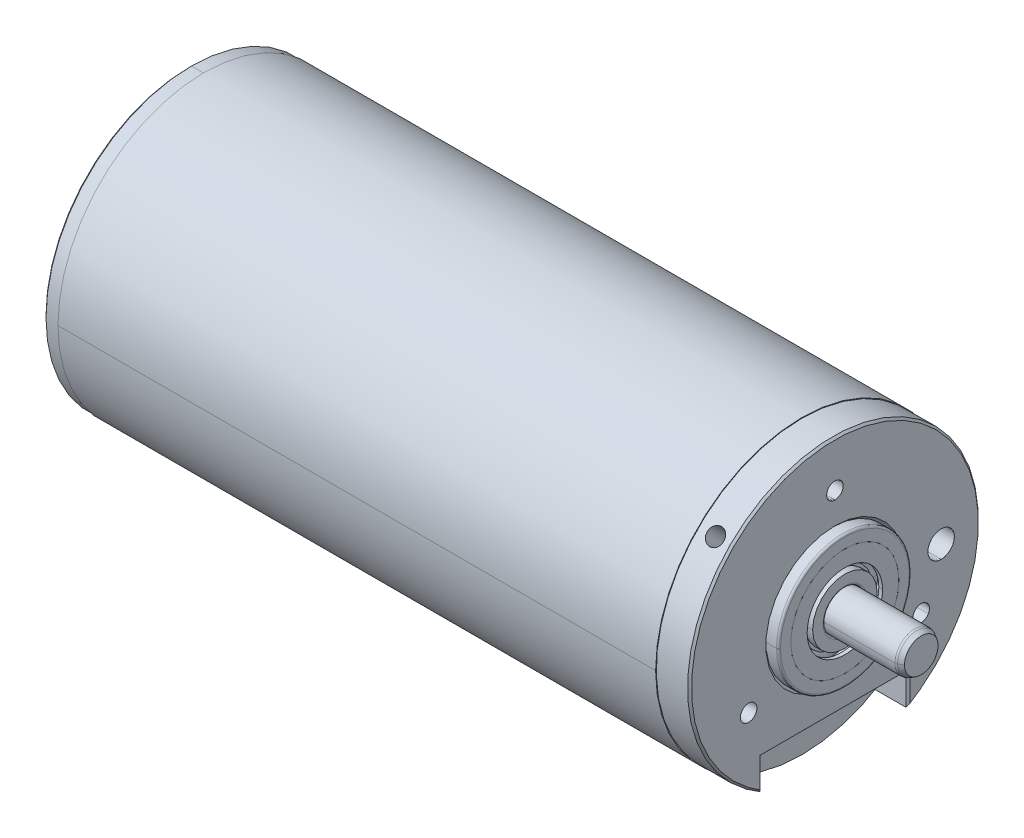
SolidWorks part; units mm, degrees
ref_plane "Front Plane" through (0, 0, 0) normal (0, 0, 1) x (1, 0, 0)
ref_plane "Top Plane" through (0, 0, 0) normal (0, 1, 0) x (1, 0, 0)
ref_plane "Right Plane" through (0, 0, 0) normal (1, 0, 0) x (0, 0, -1)
imported_body "323217_ec-4pole22_90w.stp<1>"
delete or keep bodies "Body-Delete/Keep 1" type delete bodies bodies 107 106 104 105
sketch "Sketch1" plane through (46.1, 0, 0) normal (1, 0, 0) x (0, 0, -1)
  arc A0 (3.0925, -8.51) -> (4.6675, -8.51) centre (3.88, -8.51) ccw construction
  arc A1 (4.6675, -8.51) -> (3.0925, -8.51) centre (3.88, -8.51) ccw construction
  arc A2 (1.2325, -9.13) -> (2.8075, -9.13) centre (2.02, -9.13) ccw construction
  arc A3 (2.8075, -9.13) -> (1.2325, -9.13) centre (2.02, -9.13) ccw construction
  arc A4 (-0.7075, -9.35) -> (0.8675, -9.35) centre (0.08, -9.35) ccw construction
  arc A5 (0.8675, -9.35) -> (-0.7075, -9.35) centre (0.08, -9.35) ccw construction
  arc A6 (-3.9328, -9.3401) -> (-3.1998, -9.6112) centre (-3.42, -9.08) ccw construction
  arc A7 (-3.1998, -9.6112) -> (-2.4639, -9.8297) centre (-2.71, -9.31) ccw construction
  arc A8 (-2.4639, -9.8297) -> (-1.7121, -9.9877) centre (-2, -9.49) ccw construction
  arc A9 (-1.7121, -9.9877) -> (-1.5579, -9.1223) centre (-1.27, -9.62) ccw construction
  arc A10 (-1.5579, -9.1223) -> (-2.2461, -8.9703) centre (-2, -9.49) ccw construction
  arc A11 (-2.2461, -8.9703) -> (-2.9302, -8.7788) centre (-2.71, -9.31) ccw construction
  arc A12 (-2.9302, -8.7788) -> (-3.5872, -8.5299) centre (-3.42, -9.08) ccw construction
  arc A13 (-3.5872, -8.5299) -> (-3.9328, -9.3401) centre (-4.1, -8.79) ccw construction
  arc A14 (3.0925, -8.51) -> (4.6675, -8.51) centre (3.88, -8.51) ccw
  arc A15 (4.6675, -8.51) -> (3.0925, -8.51) centre (3.88, -8.51) ccw
  arc A16 (1.2325, -9.13) -> (2.8075, -9.13) centre (2.02, -9.13) ccw
  arc A17 (2.8075, -9.13) -> (1.2325, -9.13) centre (2.02, -9.13) ccw
  arc A18 (-0.7075, -9.35) -> (0.8675, -9.35) centre (0.08, -9.35) ccw
  arc A19 (0.8675, -9.35) -> (-0.7075, -9.35) centre (0.08, -9.35) ccw
  arc A20 (-3.9328, -9.3401) -> (-3.1998, -9.6112) centre (-3.42, -9.08) ccw
  arc A21 (-3.1998, -9.6112) -> (-2.4639, -9.8297) centre (-2.71, -9.31) ccw
  arc A22 (-2.4639, -9.8297) -> (-1.7121, -9.9877) centre (-2, -9.49) ccw
  arc A23 (-1.7121, -9.9877) -> (-1.5579, -9.1223) centre (-1.27, -9.62) ccw
  arc A24 (-1.5579, -9.1223) -> (-2.2461, -8.9703) centre (-2, -9.49) ccw
  arc A25 (-2.2461, -8.9703) -> (-2.9302, -8.7788) centre (-2.71, -9.31) ccw
  arc A26 (-2.9302, -8.7788) -> (-3.5872, -8.5299) centre (-3.42, -9.08) ccw
  arc A27 (-3.5872, -8.5299) -> (-3.9328, -9.3401) centre (-4.1, -8.79) ccw
extrude "Cut-Extrude1" cut sketch "Sketch1" along normal blind 10
sketch "Sketch2" plane through (-10, 0, 0) normal (-1, 0, 0) x (0, 0, 1)
  arc A0 (-1.65, 0) -> (1.65, 0) centre (0, 0) ccw construction
  arc A1 (1.65, 0) -> (-1.65, 0) centre (0, 0) ccw construction
  arc A2 (-1.65, 0) -> (1.65, 0) centre (0, 0) ccw
  arc A3 (1.65, 0) -> (-1.65, 0) centre (0, 0) ccw
extrude "Cut-Extrude2" cut sketch "Sketch2" against normal up to surface (8.95 mm away)
